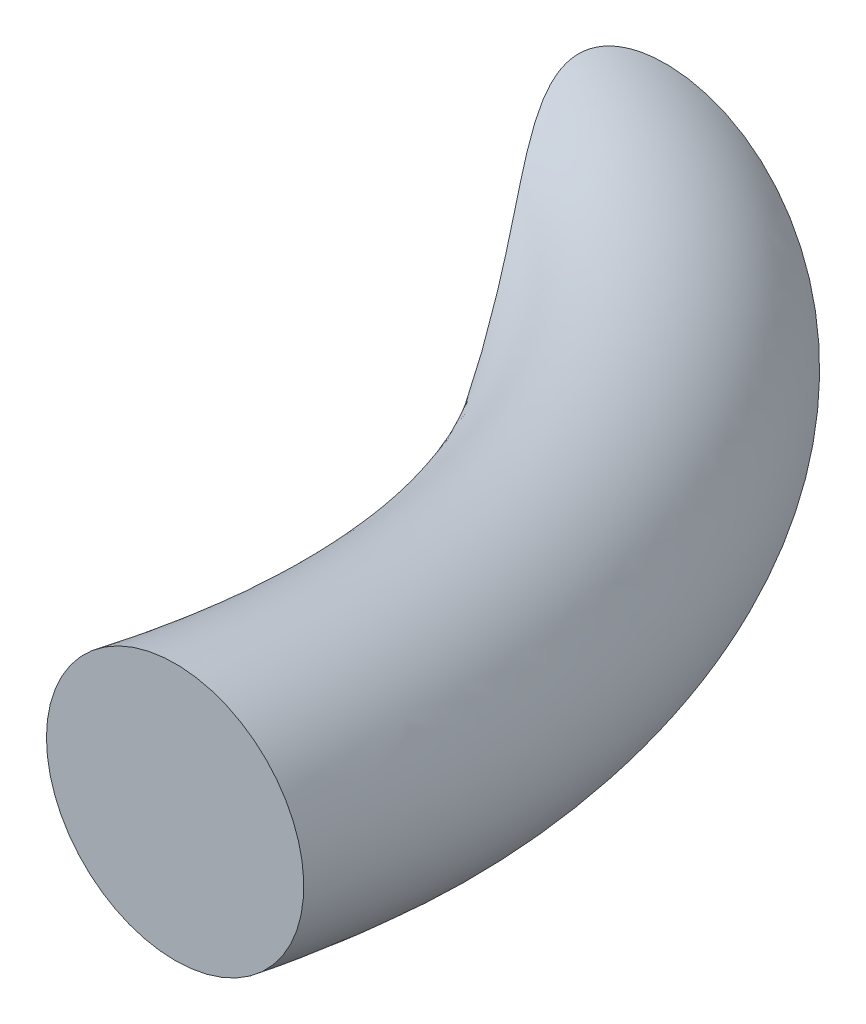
SolidWorks part; units mm, degrees
ref_plane "Ön Düzlem" through (0, 0, 0) normal (0, 0, 1) x (1, 0, 0)
ref_plane "Üst Düzlem" through (0, 0, 0) normal (0, 1, 0) x (1, 0, 0)
ref_plane "Sağ Düzlem" through (0, 0, 0) normal (1, 0, 0) x (0, 0, -1)
sketch "Çizim1" plane through (0, 0, 0) normal (0, 0, 1) x (1, 0, 0)
  line L0 (0, 0) -> (0, 30)
  dimension "D1" = 30
sketch "Çizim3" plane through (0, 0, 0) normal (0, 0, 1) x (1, 0, 0)
  line L0 (0, 0) -> (0, 30) construction
  circle A0 centre (-45, 5) radius 5
  dimension "D1" = 10
  dimension "D2" = 45
  dimension "D3" = 5
sweep "Süpür1" add profiles "Çizim3" path "Çizim1" parameters "D1"=180
sketch "Çizim4" plane through (0, 0, 0) normal (0, 0, 1) x (1, 0, 0)
  point P0 (45, 35)
sketch "Çizim5" plane through (0, 0, 0) normal (0, 0, 1) x (1, 0, 0)
  point P0 (-45, 5)
sketch "Çizim8" plane through (0, 0, 0) normal (0, 0, 1) x (1, 0, 0)
  line L0 (-45, 10) -> (45, 30)
  circle A0 centre (-45, 5) radius 5 construction
  circle A1 centre (45, 35) radius 5 construction
sketch "Çizim9" plane through (0, 0, 0) normal (0, 0, 1) x (1, 0, 0)
  line L0 (59.4619, 30) -> (-51.9781, 30)
  line L1 (-51.9781, 30) -> (-51.9781, -3.2407)
  line L2 (-51.9781, -3.2407) -> (59.4619, -3.2407)
  line L3 (59.4619, -3.2407) -> (59.4619, 30)
extrude "Kes-Ekstrüzyon1" cut sketch "Çizim9" against normal blind 60
